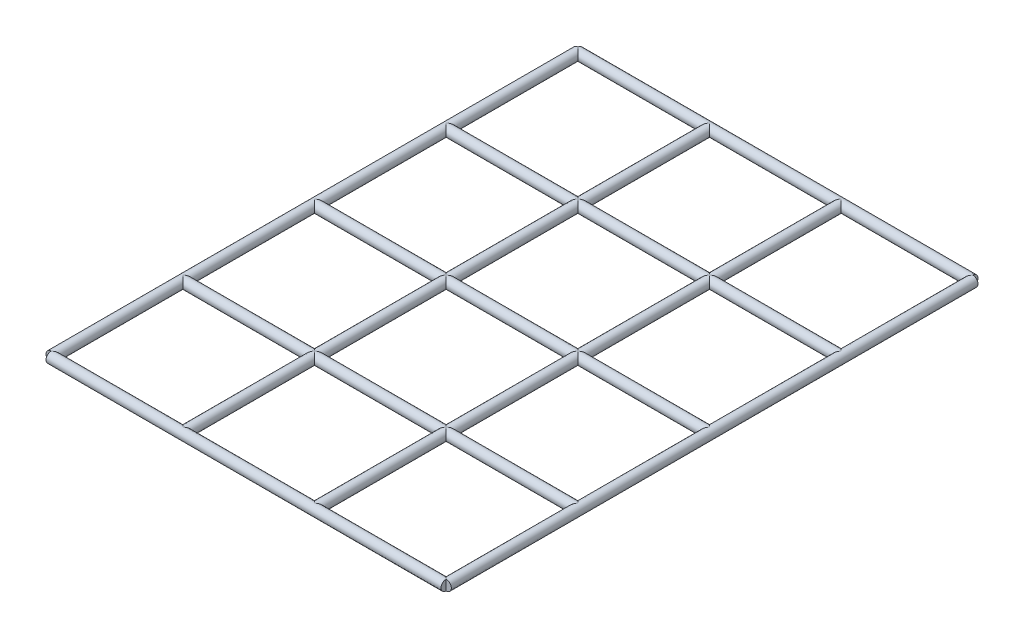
SolidWorks part; units mm, degrees
ref_plane "Plane1" through (0, 0, 0) normal (0, 0, 1) x (1, 0, 0)
ref_plane "Plane2" through (0, 0, 0) normal (0, 1, 0) x (1, 0, 0)
ref_plane "Plane3" through (0, 0, 0) normal (1, 0, 0) x (0, 0, -1)
sketch "Sketch1" plane through (0, 0, 0) normal (0, 0, 1) x (1, 0, 0)
  circle A0 centre (0, 0) radius 1.9812
  dimension "D2" = 3.9624
sketch "Sketch2" plane through (0, 0, 0) normal (1, 0, 0) x (0, 0, -1)
  circle A0 centre (0, 0) radius 1.9812
  dimension "D2" = 3.9624
extrude "Base-Extrude" add sketch "Sketch1" against normal blind 203.2
extrude "Boss-Extrude1" add sketch "Sketch2" along normal blind 152.4
sketch "Sketch3" plane through (0, 0, 0) normal (0, 1, 0) x (1, 0, 0)
  line L0 (0, 0) -> (0, 25.4) construction
  line L1 (0, 0) -> (25.4, 0) construction
  dimension "D1" = 25.4
  dimension "D2" = 25.4
pattern_linear "LPattern1" count 4 spacing 50.8 along (1, 0, 0) of "Base-Extrude"
pattern_linear "LPattern2" count 5 spacing 50.8 along (0, 0, -1) of "Boss-Extrude1"
sketch "Sketch4" plane through (0, 0, 0) normal (0, 1, 0) x (1, 0, 0)
  line L0 (0, 0) -> (152.4, 0) construction
  line L1 (152.4, 203.2) -> (152.4, 0) construction
  line L2 (0, 0) -> (0, 203.2) construction
  line L3 (0, 203.2) -> (0, 0) construction
  line L4 (0, 203.2) -> (-1.9812, 203.2) construction
  point P5 (76.2, 0)
  point P9 (0, 101.6)
ref_plane "Plane4" through (76.2, 0, 0) normal (1, 0, 0) x (0, 0, -1)
ref_plane "Plane5" through (0, 0, -101.6) normal (0, 0, 1) x (1, 0, 0)
